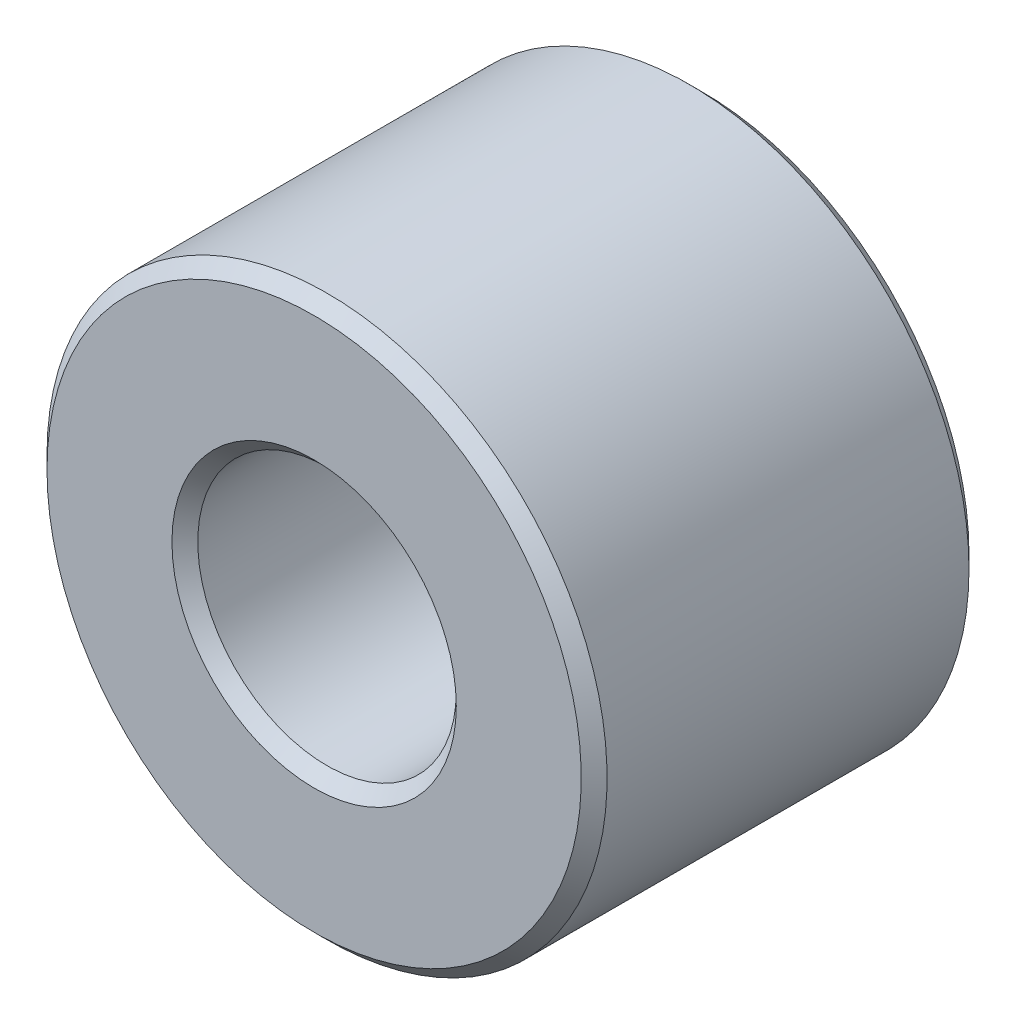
SolidWorks part; units mm, degrees
ref_plane "Front Plane" through (0, 0, 0) normal (0, 0, 1) x (1, 0, 0)
ref_plane "Top Plane" through (0, 0, 0) normal (0, 1, 0) x (1, 0, 0)
ref_plane "Right Plane" through (0, 0, 0) normal (1, 0, 0) x (0, 0, -1)
sketch "Sketch1" plane through (0, 0, 0) normal (0, 0, 1) x (1, 0, 0)
  circle A0 centre (0, 0) radius 6
  circle A1 centre (0, 0) radius 13
  dimension "D1" = 12
  dimension "D2" = 26
extrude "Boss-Extrude1" add sketch "Sketch1" along normal mid plane 18
chamfer "Chamfer1" distance 0.6 angle 45 4 edges at (6, 0, -9) (13, 0, -9) (6, 0, 9) (13, 0, 9)
